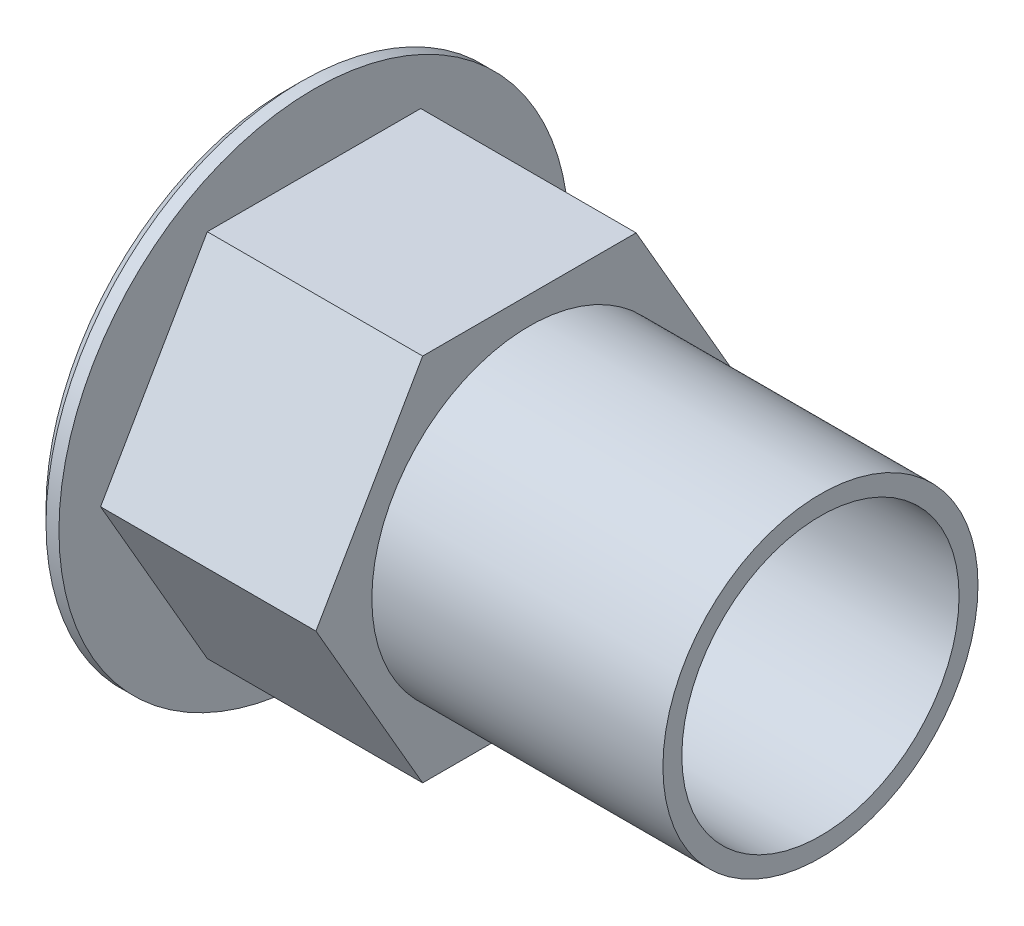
SolidWorks part; units mm, degrees
ref_plane "Front Plane" through (0, 0, 0) normal (0, 0, 1) x (1, 0, 0)
ref_plane "Top Plane" through (0, 0, 0) normal (0, 1, 0) x (1, 0, 0)
ref_plane "Right Plane" through (0, 0, 0) normal (1, 0, 0) x (0, 0, -1)
sketch "Sketch1" plane through (0, 0, 0) normal (0, 0, 1) x (1, 0, 0)
  line L0 (0, 0) -> (13.5536, 0) construction
  line L1 (0, 4.7625) -> (0, 8.3185)
  line L2 (0, 8.3185) -> (0.4445, 8.763)
  line L3 (0.4445, 8.763) -> (0.889, 8.763)
  line L4 (0.889, 8.763) -> (0.889, 5.4125)
  line L5 (0.889, 5.4125) -> (18.288, 5.4125)
  line L8 (18.288, 5.4125) -> (18.288, 4.7625)
  line L10 (0, 4.7625) -> (18.288, 4.7625)
revolve "Revolve1" add sketch "Sketch1" angle 360 about L0
sketch "Sketch2" plane through (0.889, 0, 0) normal (1, 0, 0) x (0, 0, -1)
  line L1 (7.3323, 0) -> (3.6662, 6.35)
  line L2 (3.6662, 6.35) -> (-3.6662, 6.35)
  line L3 (-3.6662, 6.35) -> (-7.3323, 0)
  line L4 (-7.3323, 0) -> (-3.6662, -6.35)
  line L5 (-3.6662, -6.35) -> (3.6662, -6.35)
  line L6 (3.6662, -6.35) -> (7.3323, 0)
  circle A0 centre (0, 0) radius 6.35 construction
  circle A1 centre (0, 0) radius 5.4125 construction
  circle A2 centre (0, 0) radius 5.4125
  dimension "D" = 12.7
extrude "Extrude1" add sketch "Sketch2" along normal blind 7.399
surface "Surface-Offset1" [suppressed] parameters "D1"=0.254
equation "\"D1@Extrude1\" = \"A@Sketch1\"-(10/25.4)"
equation "\"D4@Sketch1\" = \"C@Sketch1\"/2"
equation "\"D7@Sketch1\" = \"Hole dia@Sketch1\"+(1.3/25.4)"
